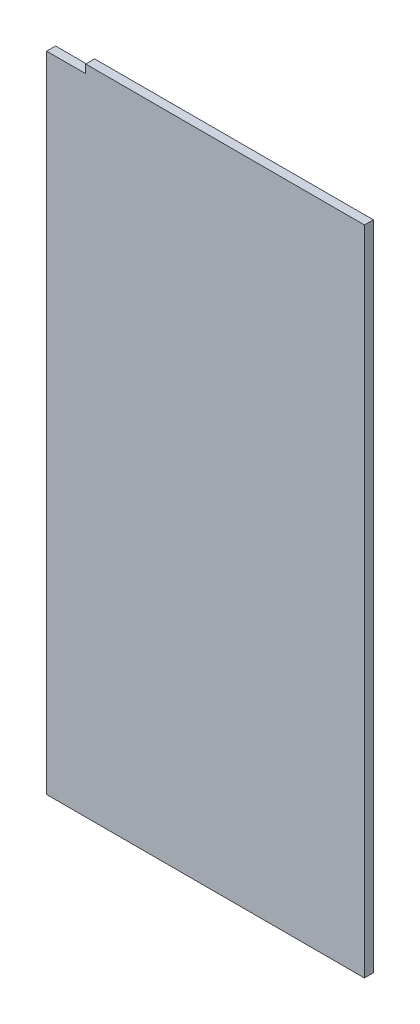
SolidWorks part; units mm, degrees
ref_plane "Plan de face" through (0, 0, 0) normal (0, 0, 1) x (1, 0, 0)
ref_plane "Plan de dessus" through (0, 0, 0) normal (0, 1, 0) x (1, 0, 0)
ref_plane "Plan de droite" through (0, 0, 0) normal (1, 0, 0) x (0, 0, -1)
sketch "Esquisse1" plane through (0, 0, 0) normal (0, 0, 1) x (1, 0, 0)
  line L0 (0, 0) -> (570, 0)
  line L1 (570, 0) -> (570, 1170)
  line L2 (570, 1170) -> (70, 1170)
  line L3 (70, 1170) -> (70, 1155)
  line L4 (70, 1155) -> (0, 1155)
  line L5 (0, 1155) -> (0, 0)
  dimension "D1" = 570
  dimension "D2" = 1170
  dimension "D3" = 70
  dimension "D4" = 15
extrude "Extrusion1" add sketch "Esquisse1" along normal blind 16
ref_plane "Plan Médian" through (285, 0, 0) normal (-1, 0, 0) x (0, 0, 1)
